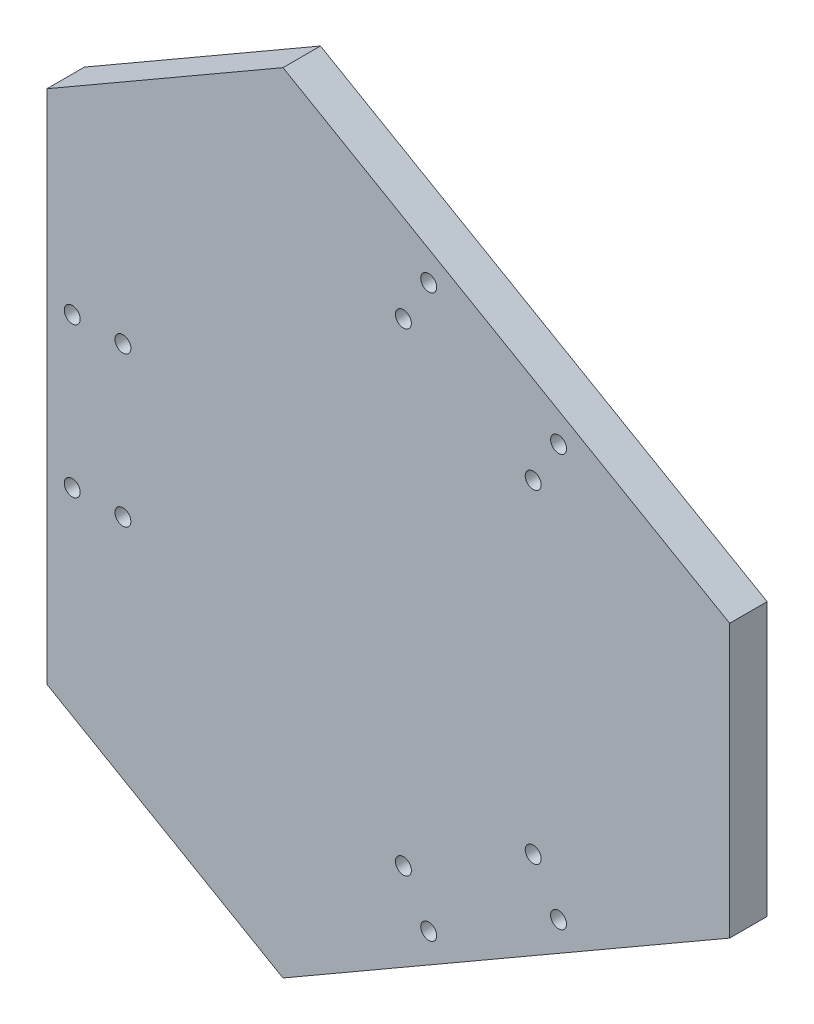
SolidWorks part; units mm, degrees
ref_plane "Front Plane" through (0, 0, 0) normal (1, 0, 0) x (0, 1, 0)
ref_plane "Top Plane" through (0, 0, 0) normal (0, 0, 1) x (0, 1, 0)
ref_plane "Right Plane" through (0, 0, 0) normal (0, 1, 0) x (-1, 0, 0)
sketch "Sketch1" plane through (0, 0, 0) normal (0, 0, 1) x (0, 1, 0)
  line L0 (0, 0) -> (-127.8293, 0) construction
  line L4 (0, -207.5586) -> (179.751, 103.7793) construction
  line L5 (150, 86.6025) -> (-150, 86.6025) construction
  line L6 (-150, 86.6025) -> (0, -173.2051) construction
  line L7 (0, -173.2051) -> (150, 86.6025) construction
  line L8 (179.751, 103.7793) -> (-179.751, 103.7793) construction
  line L9 (-179.751, 103.7793) -> (0, -207.5586) construction
  line L10 (-133.563, 23.7793) -> (-87.375, 103.7793)
  line L11 (0, 0) -> (0, 103.7793) construction
  line L12 (-25.4, 86.6025) -> (-25.4, 103.7793) construction
  line L13 (87.375, 103.7793) -> (133.563, 23.7793)
  line L14 (46.188, -127.5586) -> (-46.188, -127.5586)
  line L15 (-46.188, -127.5586) -> (-133.563, 23.7793)
  line L16 (46.188, -127.5586) -> (133.563, 23.7793)
  line L17 (87.375, 103.7793) -> (-87.375, 103.7793)
  circle A0 centre (0, 0) radius 86.6025 construction
  point P17 (-25.4, 95.1909)
  point P18 (-25.4, 78.0142)
  point P19 (25.4, 95.1909)
  point P20 (25.4, 78.0142)
  point P26 (95.1378, -25.5984)
  point P27 (80.2622, -17.01)
  point P28 (69.7378, -69.5925)
  point P29 (54.8622, -61.0041)
  point P32 (-69.7378, -69.5925)
  point P33 (-54.8622, -61.0041)
  point P34 (-95.1378, -25.5984)
  point P35 (-80.2622, -17.01)
  dimension "D1" = 300
  dimension "D3" = 80
  dimension "D4" = 25.4
  dimension "D2" = 17.1767
  dimension "D5" = 3
extrude "Boss-Extrude1" add sketch "Sketch1" against normal mid plane 12.7
hole_wizard "Tap Drill for 1/4-28 Tap1" positions "Sketch2" profile "Sketch3" hole size "1/4-28" standard "ANSI Inch"
sketch "Sketch2" plane through (0, 0, 6.35) normal (0, 0, 1) x (1, 0, 0)
  point P0 (17.01, -80.2622)
  point P3 (25.5984, -95.1378)
  point P6 (69.5925, -69.7378)
  point P9 (61.0041, -54.8622)
  point P12 (61.0041, 54.8622)
  point P15 (69.5925, 69.7378)
  point P18 (25.5984, 95.1378)
  point P21 (17.01, 80.2622)
  point P24 (-78.0142, 25.4)
  point P27 (-95.1909, 25.4)
  point P30 (-95.1909, -25.4)
  point P33 (-78.0142, -25.4)
sketch "Sketch3" plane through (17.01, -80.2622, 6.35) normal (1, 0, 0) x (0, -1, 0)
  line L0 (0, 0) -> (0, 14.3254)
  line L1 (0, 14.3254) -> (2.7051, 12.7)
  line L2 (2.7051, 12.7) -> (2.7051, 0)
  line L5 (2.7051, 0) -> (0, 0)
  line L10 (0, 14.3254) -> (-2.7051, 12.7) construction
  line L11 (0, -6.35) -> (0, 107.95) construction
  dimension "Hole Dia." = 5.4102
  dimension "Hole Depth" = 12.7
  dimension "Drill Angle" = 118
